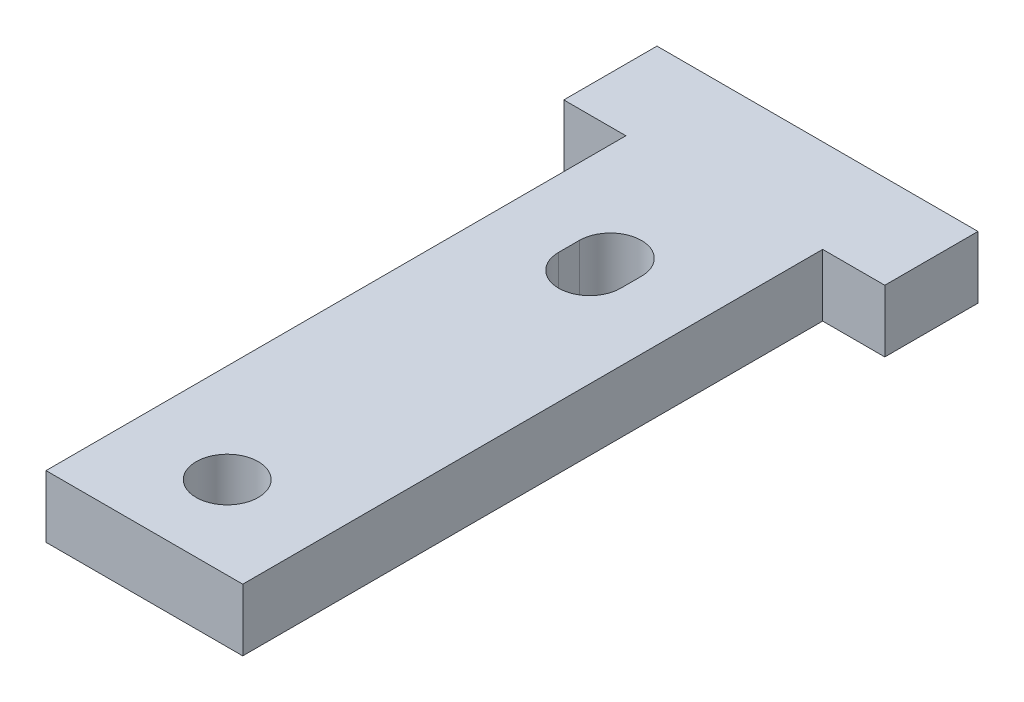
SolidWorks part; units mm, degrees
ref_plane "Front Plane" through (0, 0, 0) normal (0, 0, 1) x (1, 0, 0)
ref_plane "Top Plane" through (0, 0, 0) normal (0, 1, 0) x (1, 0, 0)
ref_plane "Right Plane" through (0, 0, 0) normal (1, 0, 0) x (0, 0, -1)
sketch "Sketch1" plane through (0, 0, 0) normal (0, 1, 0) x (1, 0, 0)
  line L0 (0, -83.7849) -> (0, 83.7849) construction
  line L1 (-7.75, -0.7068) -> (7.75, -0.7068)
  line L2 (7.75, -0.7068) -> (7.75, -5.2068)
  line L3 (7.75, -5.2068) -> (4.75, -5.2068)
  line L4 (4.75, -5.2068) -> (4.75, -33.2068)
  line L5 (4.75, -33.2068) -> (-4.75, -33.2068)
  line L6 (0, -33.2068) -> (0, -29.2068) construction
  line L7 (0, -0.7068) -> (0, -8.7068) construction
  line L8 (0, -8.7068) -> (0, -13.7068) construction
  line L9 (-1.5, -10.9858) -> (1.5, -10.9858) construction
  line L10 (1.5, -11.2648) -> (1.5, -10.7068)
  line L11 (0, -8.7068) -> (0, -10.7068) construction
  line L12 (0, -13.7068) -> (0, -11.7068) construction
  line L13 (-1.5, -11.2648) -> (-1.5, -10.7068)
  line L14 (-4.75, -5.2068) -> (-4.75, -33.2068)
  line L15 (-7.75, -5.2068) -> (-4.75, -5.2068)
  line L16 (-7.75, -0.7068) -> (-7.75, -5.2068)
  line L17 (-1.5, -11.2648) -> (-1.5, -11.7068)
  line L18 (1.5, -11.2648) -> (1.5, -11.7068)
  line L20 (-3.1703, -27.7068) -> (2.5628, -27.7068) construction
  circle A0 centre (0, -29.2068) radius 1.5
  arc A3 (-1.5, -11.7068) -> (1.5, -11.7068) centre (0, -11.7068) ccw
  arc A4 (1.5, -10.7068) -> (-1.5, -10.7068) centre (0, -10.7068) ccw
  point P4 (0, 0)
  point P17 (0, -10.9858)
  point P19 (1.5, -10.9858)
  point P30 (-1.5, -10.9858)
  dimension "D1" = 16
  dimension "D5" = 3
  dimension "D3" = 7.75
  dimension "D4" = 3
  dimension "D6" = 1.5
extrude "Boss-Extrude1" add sketch "Sketch1" along normal blind 3
